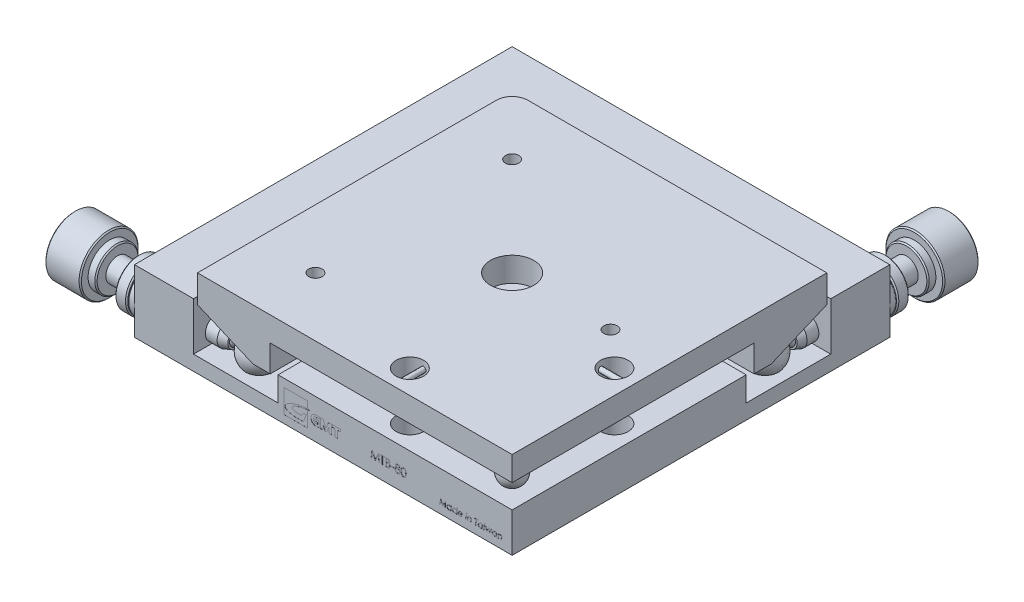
SolidWorks part; units mm, degrees
ref_plane "前基準面" through (0, 0, 0) normal (0, 0, 1) x (1, 0, 0)
ref_plane "上基準面" through (0, 0, 0) normal (0, 1, 0) x (1, 0, 0)
ref_plane "右基準面" through (0, 0, 0) normal (1, 0, 0) x (0, 0, -1)
sketch "草圖1" plane through (0, 0, 0) normal (0, 1, 0) x (1, 0, 0)
  line L1 (0, 0) -> (96, 0)
  line L2 (0, 0) -> (0, 96)
  line L3 (0, 96) -> (96, 96)
  line L4 (96, 0) -> (96, 96)
  dimension "D1" = 96
  dimension "D2" = 96
extrude "伸長1" add sketch "草圖1" along normal blind 16
sketch "草圖2" plane through (0, 16, 0) normal (0, 1, 0) x (1, 0, 0)
  line L1 (96, 0) -> (15, 0)
  line L2 (96, 0) -> (96, 81)
  line L3 (96, 81) -> (15, 81)
  line L4 (15, 0) -> (15, 81)
  dimension "D1" = 81
  dimension "D2" = 81
extrude "除料-伸長1" cut sketch "草圖2" against normal blind 6
sketch "草圖24" plane through (0, 10, 0) normal (0, 1, 0) x (1, 0, 0)
  line L0 (15, 0) -> (96, 0) construction
  line L1 (15, 0) -> (36.5, 0)
  line L2 (15, 0) -> (15, 15)
  line L3 (15, 15) -> (36.5, 15)
  line L4 (36.5, 0) -> (36.5, 15)
  line L5 (15, 81) -> (15, 0) construction
  point P10 (36.5, 15)
  dimension "D1" = 15
  dimension "D2" = 21.5
extrude "除料-伸長7" cut sketch "草圖24" against normal blind 6.2
sketch "草圖25" plane through (0, 10, 0) normal (0, 1, 0) x (1, 0, 0)
  line L1 (96, 81) -> (81, 81)
  line L2 (96, 81) -> (96, 59.5)
  line L3 (96, 59.5) -> (81, 59.5)
  line L4 (81, 81) -> (81, 59.5)
  point P7 (81, 59.5)
  dimension "D1" = 15
  dimension "D2" = 21.5
extrude "除料-伸長8" cut sketch "草圖25" against normal blind 6.2
ref_plane "平面1" through (0, 22.2, 0) normal (0, 1, 0) x (-1, 0, 0)
sketch "草圖3" plane through (0, 22.2, 0) normal (0, 1, 0) x (-1, 0, 0)
  line L1 (-96, 0) -> (-16, 0)
  line L2 (-96, 0) -> (-96, -80)
  line L3 (-96, -80) -> (-16, -80)
  line L4 (-16, 0) -> (-16, -80)
  dimension "D1" = 80
  dimension "D2" = 80
extrude "伸長2" add sketch "草圖3" against normal blind 13
fillet "圓角2" radius 4 1 edges at (16, 16.1, -80)
sketch "草圖4" plane through (0, 0, 0) normal (0, 0, 1) x (1, 0, 0)
  line L0 (16, 15.1851) -> (16, 9.2)
  line L1 (16, 9.2) -> (30.1, 9.2)
  line L6 (16, 15.1851) -> (30.1, 9.2)
  line L7 (16, 9.2) -> (16, 22.2) construction
  dimension "D1" = 113
  dimension "D4" = 14.1
extrude "除料-伸長4" cut sketch "草圖4" against normal blind 12.3
sketch "草圖7" plane through (96, 0, 0) normal (1, 0, 0) x (0, 0, -1)
  line L0 (65.8649, 9.2) -> (80, 15.2)
  line L3 (80, 15.2) -> (80, 9.2)
  line L4 (65.8649, 9.2) -> (80, 9.2)
  line L7 (59.5, 9.2) -> (80, 9.2) construction
  line L8 (80, 9.2) -> (80, 22.2) construction
  dimension "D1" = 113
  dimension "D2" = 15.3558
extrude "除料-伸長5" cut sketch "草圖7" against normal blind 12.3
ref_plane "平面3" through (0, 10, 0) normal (0, 1, 0) x (-1, 0, 0)
sketch "草圖10" plane through (0, 10, 0) normal (0, 1, 0) x (-1, 0, 0)
  line L0 (-96, -80) -> (-20, -80) construction
  line L1 (-83.7, -61.5) -> (-96, -61.5)
  line L2 (-83.7, -61.5) -> (-83.7, -80)
  line L3 (-83.7, -80) -> (-20, -80)
  line L4 (-16, -12.3) -> (-16, -76)
  line L5 (-16, -76) -> (-16, 0) construction
  line L6 (-96, 0) -> (-96, -80) construction
  line L9 (-96, -61.5) -> (-96, 0)
  line L10 (-96, 0) -> (-34.5, 0)
  line L11 (-16, 0) -> (-96, 0) construction
  line L12 (-34.5, 0) -> (-34.5, -12.3)
  line L13 (-34.5, -12.3) -> (-16, -12.3)
  line L14 (-96, -59.5) -> (-96, -65.8649) construction
  arc A0 (-20, -80) -> (-16, -76) centre (-20, -76) ccw
  point P19 (-96, -62.6824)
  dimension "D3" = 4
  dimension "D1" = 12.3
  dimension "D2" = 12.3
  dimension "D4" = 61.5
  dimension "D5" = 61.5
extrude "除料-伸長6" cut sketch "草圖10" along normal blind 6
sketch "草圖36" plane through (0, 10, 0) normal (0, 1, 0) x (-1, 0, 0)
  line L0 (-96, -61.5) -> (-83.7, -61.5)
  line L1 (-96, 0) -> (-96, -80) construction
  line L2 (-83.7, -61.5) -> (-83.7, -80)
  line L3 (-96, -80) -> (-20, -80) construction
  line L4 (-83.7, -80) -> (-81, -80)
  line L5 (-81, -80) -> (-81, -59.5)
  line L6 (-81, -59.5) -> (-96, -59.5)
  line L7 (-96, -59.5) -> (-96, -61.5)
  line L8 (-36.5, 0) -> (-36.5, -15)
  line L9 (-16, 0) -> (-96, 0) construction
  line L10 (-36.5, -15) -> (-16, -15)
  line L11 (-16, -76) -> (-16, 0) construction
  line L12 (-16, -15) -> (-16, -12.3)
  line L13 (-16, -12.3) -> (-34.5, -12.3)
  line L14 (-34.5, -12.3) -> (-34.5, 0)
  line L15 (-34.5, 0) -> (-36.5, 0)
  dimension "D1" = 2
  dimension "D2" = 2.7
  dimension "D3" = 12.3
  dimension "D4" = 18.5
  dimension "D5" = 2
  dimension "D6" = 2.7
  dimension "D7" = 12.3
  dimension "D8" = 18.5
extrude "除料-伸長10" cut sketch "草圖36" against normal blind 5
fillet "圓角3" radius 4 5 edges at (15, 13, -81) (81, 6.9, -59.5) (81, 6.9, -81) (36.5, 6.9, -15) (15, 6.9, -15)
ref_plane "平面4" through (0, 6.8, 0) normal (0, -1, 0) x (1, 0, 0)
sketch "草圖17" plane through (0, 6.8, 0) normal (0, -1, 0) x (1, 0, 0)
  line L0 (90, -96) -> (95.45, -96)
  line L1 (96, -101) -> (96, -98)
  line L2 (97.5, -117.2316) -> (90, -117.2316)
  line L4 (96, -98) -> (95.45, -98)
  line L5 (93, -101) -> (96, -101)
  line L6 (95.5, -106.2316) -> (93, -106.2316)
  line L7 (97.5, -108.2316) -> (95.5, -108.2316)
  line L10 (95.75, -96.3) -> (95.75, -97.7)
  line L11 (95.75, -97.7) -> (95.45, -98)
  line L12 (95.45, -96) -> (95.75, -96.3)
  line L13 (93, -101) -> (93, -106.2316)
  line L15 (95.5, -106.2316) -> (95.5, -108.2316)
  line L16 (97.5, -108.2316) -> (97.5, -117.2316)
  line L17 (90, -96) -> (90, -117.2316)
  line L18 (90, -85.1872) -> (90, -42.7621) construction
  line L20 (96, -81) -> (96, -96) construction
  line L21 (96, -96) -> (0, -96) construction
  point P2 (0, 0)
  dimension "D2" = 6
  dimension "D3" = 7.5
  dimension "D4" = 9
  dimension "D5" = 21.2316
  dimension "D6" = 5.5
  dimension "D7" = 3
  dimension "D8" = 12
  dimension "D9" = 11.5
  dimension "D14" = 2
  dimension "D19" = 3
  dimension "D20" = 5.2317
  dimension "D21" = 0.3
  dimension "D22" = 0.3
  dimension "D23" = 0.3
  dimension "D24" = 0.3
revolve "旋轉-薄件1" add sketch "草圖17" angle 360 about L18
chamfer "導角1" distance 0.3 angle 45 6 edges at (84.5501, 6.8, -98) (84, 6.8, -98) (84, 6.8, -101) (84.5, 6.8, -106.2316) (82.5, 6.8, -108.2316) (82.5, 6.8, -117.2316)
sketch "草圖19" plane through (0, 6.8, 0) normal (0, -1, 0) x (1, 0, 0)
  line L0 (90, -24.2869) -> (90, -85.3982) construction
  line L1 (90, -81) -> (92.975, -81)
  line L2 (92.975, -81) -> (92.975, -78)
  line L3 (92.975, -78) -> (92.3, -76.1455)
  line L5 (96, 0) -> (96, -80) construction
  line L6 (90, -74.8) -> (90, -81)
  line L7 (96, -81) -> (19, -81) construction
  line L8 (92.3, -76.1455) -> (91.8899, -76.1455)
  arc A0 (91.8899, -76.1455) -> (90, -74.8) centre (90, -76.8) ccw
  dimension "D5" = 20
  dimension "D4" = 4
  dimension "D7" = 3
  dimension "D2" = 6
  dimension "D3" = 5.95
  dimension "D6" = 6.2
  dimension "D8" = 2.3
revolve "旋轉7" add sketch "草圖19" angle 360 about L0
sketch "草圖22" plane through (0, 6.8, 0) normal (0, -1, 0) x (1, 0, 0)
  line L0 (0, -6) -> (0, -0.55)
  line L1 (-5, 0) -> (-2, 0)
  line L2 (-21.3, 1.5) -> (-21.3, -6)
  line L3 (0, 0) -> (15, 0) construction
  line L4 (-2, 0) -> (-2, -0.55)
  line L5 (-5, -3) -> (-5, 0)
  line L6 (-10.3, -0.5) -> (-10.3, -3)
  line L7 (-12.3, 1.5) -> (-12.3, -0.5)
  line L8 (0, -96) -> (0, 0) construction
  line L9 (0, -6) -> (-21.3, -6)
  line L10 (-0.3, -0.25) -> (-1.7, -0.25)
  line L11 (-1.7, -0.25) -> (-2, -0.55)
  line L12 (0, -0.55) -> (-0.3, -0.25)
  line L13 (-5, -3) -> (-10.3, -3)
  line L15 (-10.3, -0.5) -> (-12.3, -0.5)
  line L16 (-12.3, 1.5) -> (-21.3, 1.5)
  line L18 (38.7378, -6) -> (-35.4089, -6) construction
  dimension "D1" = 6
  dimension "D2" = 14.9999
  dimension "D3" = 10.9999
  dimension "D4" = 5.9999
  dimension "D5" = 11.9999
  dimension "D6" = 5.75
  dimension "D7" = 9
  dimension "D8" = 21.3
  dimension "D9" = 2
  dimension "D10" = 5.3
  dimension "D11" = 0.3
  dimension "D12" = 0.3
  dimension "D13" = 0.3
  dimension "D14" = 0.3
  dimension "D15" = 3
revolve "旋轉8" add sketch "草圖22" angle 360 about L18
chamfer "導角2" distance 0.3 angle 45 5 edges at (-21.3, 6.8, -13.5) (-12.3, 6.8, -13.5) (-10.3, 6.8, -11.5) (-5, 6.8, -12) (-2, 6.8, -12)
sketch "草圖23" plane through (0, 6.8, 0) normal (0, -1, 0) x (1, 0, 0)
  line L0 (35.4631, -6) -> (-29.8584, -6) construction
  line L1 (15, -6) -> (15, -3.001)
  line L2 (15, -77) -> (15, -11) construction
  line L3 (15, -3.001) -> (18, -3.001)
  line L4 (18, -3.001) -> (20, -3.7289)
  line L5 (20, -3.7289) -> (20, -4.167)
  line L7 (16, 0) -> (96, 0) construction
  line L9 (15, -6) -> (21.2, -6)
  arc A0 (21.2, -6) -> (20, -4.167) centre (19.2, -6) ccw
  dimension "D3" = 6.2
  dimension "D2" = 6
  dimension "D4" = 3
  dimension "D5" = 2.999
  dimension "D6" = 20
  dimension "D7" = 5
revolve "旋轉9" add sketch "草圖23" angle 360 about L0
hole_wizard "M6 承窩頭蓋螺釘的柱孔1" positions "草圖27" profile "草圖26" counterbore size "M6" standard "JIS"
sketch "草圖27" plane through (0, 22.2, 0) normal (0, 1, 0) x (-1, 0, 0)
  line L0 (-96, 0) -> (-96, -80) construction
  line L1 (-16, 0) -> (-96, 0) construction
  point P0 (-56, -40)
  dimension "D1" = 40
  dimension "D2" = 40
sketch "草圖26" plane through (56, 22.2, -40) normal (1, 0, 0) x (0, 0, 1)
  line L0 (0, 0) -> (0, 22.9)
  line L1 (0, 22.9) -> (3.3, 22.9)
  line L3 (3.3, 22.9) -> (3.3, 18.8)
  line L4 (3.3, 18.8) -> (5.5, 18.8)
  line L5 (5.5, 18.8) -> (5.5, 0)
  line L7 (5.5, 0) -> (0, 0)
  line L11 (0, -6.35) -> (0, 107.95) construction
  dimension "貫穿孔直徑" = 6.6
  dimension "貫穿孔深度" = 22.9
  dimension "柱孔直徑" = 11
  dimension "柱孔深度" = 18.8
hole_wizard "M4x0.7 螺紋孔2" positions "草圖33" profile "草圖32" tap size "M4x0.7" standard "JIS"
sketch "草圖33" plane through (0, 22.2, 0) normal (0, 1, 0) x (-1, 0, 0)
  line L1 (-16, 0) -> (-96, 0) construction
  line L2 (-96, -59.5) -> (-96, -81) construction
  line L3 (-96, 0) -> (-96, -80) construction
  point P0 (-31, -65)
  point P1 (-31, -15)
  point P3 (-81, -40)
  dimension "D1" = 15
  dimension "D2" = 50
  dimension "D3" = 15
  dimension "D4" = 25
  dimension "D5" = 25
  dimension "D6" = 65
sketch "草圖32" plane through (31, 22.2, -65) normal (1, 0, 0) x (0, 0, 1)
  line L0 (0, 0) -> (0, 10.5215)
  line L1 (0, 10.5215) -> (1.7, 9.5)
  line L2 (1.7, 9.5) -> (1.7, 0)
  line L5 (1.7, 0) -> (0, 0)
  line L10 (0, 10.5215) -> (-1.7, 9.5) construction
  line L11 (0, -6.35) -> (0, 107.95) construction
  dimension "螺孔鑽直徑" = 3.4
  dimension "螺孔鑽深度" = 9.5
  dimension "導頭角度" = 118
hole_wizard "Ø7.0 (7) 直徑孔1" positions "草圖31" profile "草圖30" hole size "Ø7.0" standard "JIS"
sketch "草圖31" plane through (0, 22.2, 0) normal (0, 1, 0) x (-1, 0, 0)
  line L0 (-96, 0) -> (-96, -80) construction
  line L1 (-16, 0) -> (-96, 0) construction
  point P0 (-90, -32)
  point P1 (-64, -6)
  dimension "D1" = 6
  dimension "D2" = 32
  dimension "D3" = 6
  dimension "D4" = 32
sketch "草圖30" plane through (90, 22.2, -32) normal (1, 0, 0) x (0, 0, 1)
  line L0 (0, 0) -> (0, 22.9)
  line L1 (0, 22.9) -> (3.5, 22.9)
  line L2 (3.5, 22.9) -> (3.5, 0)
  line L5 (3.5, 0) -> (0, 0)
  line L11 (0, -6.35) -> (0, 107.95) construction
  dimension "貫穿孔直徑" = 7
  dimension "貫穿孔深度" = 22.9
sketch "草圖34" plane through (0, 0, 0) normal (0, 0, 1) x (1, 0, 0)
  line L0 (96, 22.2) -> (96, 16) construction
  circle A0 centre (64, 20.2) radius 0.65
  circle A1 centre (64, 2) radius 0.65
  dimension "D1" = 1.3
  dimension "D2" = 1.3
  dimension "D3" = 18.2
  dimension "D4" = 2
  dimension "D5" = 32
extrude "伸長3" add sketch "草圖34" against normal blind 32
sketch "草圖35" plane through (96, 0, 0) normal (1, 0, 0) x (0, 0, -1)
  line L0 (0, 0) -> (96, 0) construction
  line L1 (0, 22.2) -> (0, 16) construction
  circle A0 centre (32, 20.2) radius 0.65
  circle A1 centre (32, 2) radius 0.65
  dimension "D1" = 1.3
  dimension "D2" = 1.3
  dimension "D4" = 2
  dimension "D3" = 18.2
  dimension "D5" = 32
extrude "伸長4" add sketch "草圖35" against normal blind 32
ref_plane "平面5" through (25.7, 0, 0) normal (-1, 0, 0) x (0, 0, 1)
sketch "草圖37" plane through (25.7, 0, 0) normal (-1, 0, 0) x (0, 0, 1)
  line L0 (-6, 32.0458) -> (-6, -4.3322) construction
  line L1 (0, 15.1851) -> (0, 22.2) construction
  line L3 (-96, 0) -> (0, 0) construction
  arc A0 (-6, 10.8) -> (-6, 2.8) centre (-6, 6.8) ccw
  point P4 (0, 18.6925)
  dimension "D1" = 8
  dimension "D3" = 6.8
  dimension "D2" = 6
revolve "旋轉-薄件2" add sketch "草圖37" angle 360 about L0
ref_plane "平面6" through (0, 0, -70.3) normal (0, 0, -1) x (-1, 0, 0)
sketch "草圖38" plane through (0, 0, -70.3) normal (0, 0, -1) x (-1, 0, 0)
  line L0 (-90, 30.1024) -> (-90, -10.2065) construction
  line L1 (-96, 16) -> (-96, 0) construction
  line L2 (-96, 0) -> (0, 0) construction
  line L3 (-90, 2.3) -> (-90, 11.3)
  arc A0 (-90, 11.3) -> (-90, 2.3) centre (-90, 6.8) ccw
  dimension "D1" = 9
  dimension "D3" = 6.8
  dimension "D2" = 6
revolve "旋轉10" add sketch "草圖38" angle 360 about L0
ref_plane "平面7" through (0, 0, -6) normal (0, 0, 1) x (1, 0, 0)
sketch "草圖39" plane through (0, 0, -6) normal (0, 0, 1) x (1, 0, 0)
  line L0 (90, 24.4043) -> (90, -12.0545) construction
  line L1 (16, 22.2) -> (96, 22.2) construction
  line L2 (96, 22.2) -> (96, 16) construction
  line L3 (90, 9.4) -> (90, 15.8)
  arc A0 (90, 15.8) -> (90, 9.4) centre (90, 12.6) ccw
  dimension "D1" = 6.4
  dimension "D2" = 9.6
  dimension "D3" = 6
revolve "旋轉11" add sketch "草圖39" angle 360 about L0
sketch "草圖41" plane through (0, 0, 0) normal (0, 0, 1) x (1, 0, 0)
  line L41 (38, 8.0043) -> (38, 2)
  line L42 (38, 2) -> (43.9982, 2)
  line L43 (43.9982, 2) -> (43.9982, 6.0419)
  line L44 (43.9982, 6.2269) -> (43.9982, 8.0043)
  line L45 (51.5705, 5.3274) -> (51.5705, 3.5406)
  line L46 (51.5705, 5.3274) -> (52.1686, 5.3274)
  line L47 (52.3563, 5.515) -> (52.3563, 5.9334)
  line L48 (52.3563, 5.9334) -> (50.1899, 5.9334)
  line L49 (50.1899, 5.9334) -> (50.1899, 5.3387)
  line L50 (50.1899, 5.3387) -> (50.9653, 5.3387)
  line L51 (50.9653, 5.3387) -> (50.9653, 3.7316)
  line L52 (51.1514, 3.544) -> (51.5705, 3.5406)
  line L53 (50.0273, 5.9334) -> (49.3484, 5.9334)
  line L54 (47.9457, 5.9334) -> (47.2677, 5.9334)
  line L55 (47.1118, 5.9334) -> (45.8475, 5.9334)
  line L56 (47.2677, 5.9334) -> (47.2677, 3.5455)
  line L57 (50.0264, 3.5455) -> (49.6233, 3.5455)
  line L58 (48.8225, 3.5455) -> (48.4716, 3.5455)
  line L59 (47.6708, 3.5455) -> (47.2677, 3.5455)
  line L60 (47.0988, 3.5455) -> (45.8475, 3.5455)
  line L61 (47.9457, 5.9334) -> (48.6471, 4.3072)
  line L62 (47.8584, 4.9339) -> (47.8584, 3.7331)
  line L63 (47.8584, 4.9339) -> (48.4716, 3.5455)
  line L64 (50.0264, 5.9334) -> (50.0264, 3.5455)
  line L65 (49.4357, 4.9339) -> (49.4357, 3.7331)
  line L66 (49.4357, 4.9339) -> (48.8225, 3.5455)
  line L67 (49.3484, 5.9334) -> (48.6471, 4.3072)
  line L68 (47.0988, 5.0159) -> (45.8922, 5.0159)
  line L69 (47.0988, 5.0159) -> (47.0988, 3.5455)
  line L70 (45.8922, 5.0159) -> (45.8922, 4.6941)
  line L71 (46.5793, 4.5065) -> (46.0798, 4.5065)
  line L72 (46.5793, 4.5065) -> (46.5793, 4.0498)
  line L73 (46.5793, 4.0498) -> (45.8475, 4.0498)
  line L74 (47.1118, 5.9334) -> (47.1118, 5.635)
  line L75 (45.8475, 5.4473) -> (46.9242, 5.4473)
  line L76 (42.9152, 2.8785) -> (43.6665, 4.7871)
  line L77 (43.6665, 4.7871) -> (42.9896, 4.7866)
  line L78 (42.9896, 4.7866) -> (42.3553, 3.9713)
  line L79 (44.6525, 6.2944) -> (44.6525, 6.121)
  line L80 (42.9152, 2.8785) -> (41.1376, 2.8688)
  line L81 (38, 8.0043) -> (43.9982, 8.0043)
  arc A44 (52.1686, 5.3274) -> (52.3563, 5.515) centre (52.1686, 5.515) ccw
  arc A45 (50.9653, 3.7316) -> (51.1514, 3.544) centre (51.1529, 3.7316) ccw
  arc A46 (47.6708, 3.5455) -> (47.8584, 3.7331) centre (47.6708, 3.7331) ccw
  arc A47 (49.4357, 3.7331) -> (49.6233, 3.5455) centre (49.6233, 3.7331) ccw
  arc A48 (45.8922, 4.6941) -> (46.0798, 4.5065) centre (46.0798, 4.6941) ccw
  arc A49 (46.9242, 5.4473) -> (47.1118, 5.635) centre (46.9242, 5.635) ccw
  arc A50 (45.8475, 5.4473) -> (45.8475, 4.0498) centre (46.2835, 4.7486) ccw
  arc A51 (45.8475, 5.9334) -> (45.8475, 3.5455) centre (46.0514, 4.7394) ccw
  arc A52 (41.4734, 4.0042) -> (42.3553, 3.9713) centre (42.2617, 13.297) ccw
  arc A53 (40.7516, 4.1004) -> (41.4734, 4.0042) centre (41.5081, 7.0203) ccw
  arc A54 (40.1903, 4.3302) -> (40.7516, 4.1004) centre (41.0218, 5.561) ccw
  arc A55 (40.049, 4.5755) -> (40.1903, 4.3302) centre (40.3308, 4.5745) ccw
  arc A56 (40.138, 4.7782) -> (40.049, 4.5755) centre (40.4341, 4.5272) ccw
  arc A57 (40.4401, 5.0463) -> (40.138, 4.7782) centre (41.1165, 3.9799) ccw
  arc A58 (40.8481, 5.2685) -> (40.4401, 5.0463) centre (42.1758, 2.345) ccw
  arc A59 (40.8481, 5.2685) -> (41.3546, 5.4682) centre (37.0019, 15.7653) ccw
  arc A60 (41.3546, 5.4682) -> (41.8085, 5.6036) centre (30.6495, 42.1727) ccw
  arc A61 (42.2587, 5.7218) -> (41.8085, 5.6036) centre (42.6688, 3.2418) ccw
  arc A62 (42.2587, 5.7218) -> (42.6357, 5.8005) centre (41.8168, 8.7793) ccw
  arc A63 (43.118, 5.8937) -> (42.6357, 5.8005) centre (45.6571, -8.545) ccw
  arc A64 (43.118, 5.8937) -> (43.5738, 5.9752) centre (42.684, 9.6333) ccw
  arc A65 (43.5738, 5.9752) -> (43.979, 6.0371) centre (43.4185, 8.3498) ccw
  arc A66 (44.3502, 6.0883) -> (43.979, 6.0371) centre (48.3211, -24.0526) ccw
  arc A67 (44.6525, 6.121) -> (44.3502, 6.0883) centre (44.7329, 3.9582) ccw
  arc A68 (41.1376, 2.8688) -> (40.5414, 2.9212) centre (35.8482, -53.8335) ccw
  arc A69 (39.8764, 3.0061) -> (40.5414, 2.9212) centre (41.4233, 12.4749) ccw
  arc A70 (39.0014, 3.232) -> (39.8764, 3.0061) centre (40.8435, 8.5606) ccw
  arc A71 (38.4107, 3.6116) -> (39.0014, 3.232) centre (39.6839, 4.9434) ccw
  arc A72 (38.2588, 3.9701) -> (38.4107, 3.6116) centre (38.7351, 3.9604) ccw
  arc A73 (38.4529, 4.4382) -> (38.2588, 3.9701) centre (39.0767, 3.9053) ccw
  arc A74 (38.9086, 4.8853) -> (38.4529, 4.4382) centre (40.3633, 2.9468) ccw
  arc A75 (39.4571, 5.1974) -> (38.9086, 4.8853) centre (42.5377, -0.8546) ccw
  arc A76 (39.9805, 5.4346) -> (39.4571, 5.1974) centre (42.2226, -0.2082) ccw
  arc A77 (40.3564, 5.5676) -> (39.9805, 5.4346) centre (67.3525, -71.3629) ccw
  arc A78 (40.8844, 5.7199) -> (40.3564, 5.5676) centre (42.0015, 0.8585) ccw
  arc A79 (41.4404, 5.8607) -> (40.8844, 5.7199) centre (43.0461, -1.6482) ccw
  arc A80 (41.9615, 5.9614) -> (41.4404, 5.8607) centre (44.7216, -9.7209) ccw
  arc A81 (41.9615, 5.9614) -> (42.4131, 6.0471) centre (41.3346, 10.5021) ccw
  arc A82 (42.818, 6.1041) -> (42.4131, 6.0471) centre (42.937, 3.7951) ccw
  arc A83 (43.29, 6.1598) -> (42.818, 6.1041) centre (43.4766, 2.5476) ccw
  arc A84 (43.7087, 6.2139) -> (43.29, 6.1598) centre (44.045, 1.9631) ccw
  arc A85 (44.0942, 6.2516) -> (43.7087, 6.2139) centre (44.8326, -3.2741) ccw
  arc A86 (43.8752, 6.2321) -> (44.3706, 6.2784) centre (41.1372, 38.1983) ccw
  arc A87 (44.6525, 6.2944) -> (44.3706, 6.2784) centre (44.6216, 4.3467) ccw
extrude "除料-伸長12" cut sketch "草圖41" against normal blind 0.02 and the other way through all
sketch "草圖40" plane through (0, 0, 0) normal (0, 0, 1) x (1, 0, 0)
  line L0 (38, 2) -> (44, 2)
  line L1 (44, 2) -> (44, 8)
  line L2 (38, 8) -> (38, 2)
  line L3 (38, 8) -> (44, 8)
  line L6 (36.5, 10) -> (36.5, 3.8) construction
  line L7 (85, 10) -> (19, 10) construction
  dimension "D1" = 6
  dimension "D2" = 6
  dimension "D3" = 1.5
  dimension "D4" = 2
extrude "除料-伸長11" cut sketch "草圖40" against normal blind 0.01
sketch "草圖42" plane through (0, 0, 0) normal (0, 0, 1) x (1, 0, 0)
  line L0 (73.3976, 3.5) -> (52.8122, 3.5) construction
  line L1 (0, 0) -> (96, 0) construction
  text T0 "MTB-80                             " font "Century Gothic" height 2
  dimension "D1" = 3.5
extrude "除料-伸長13" cut sketch "草圖42" against normal blind 0.02
sketch "草圖43"
  dimension "D1" = 2
extrude "除料-伸長14" cut sketch "草圖43" against normal blind 0.02
